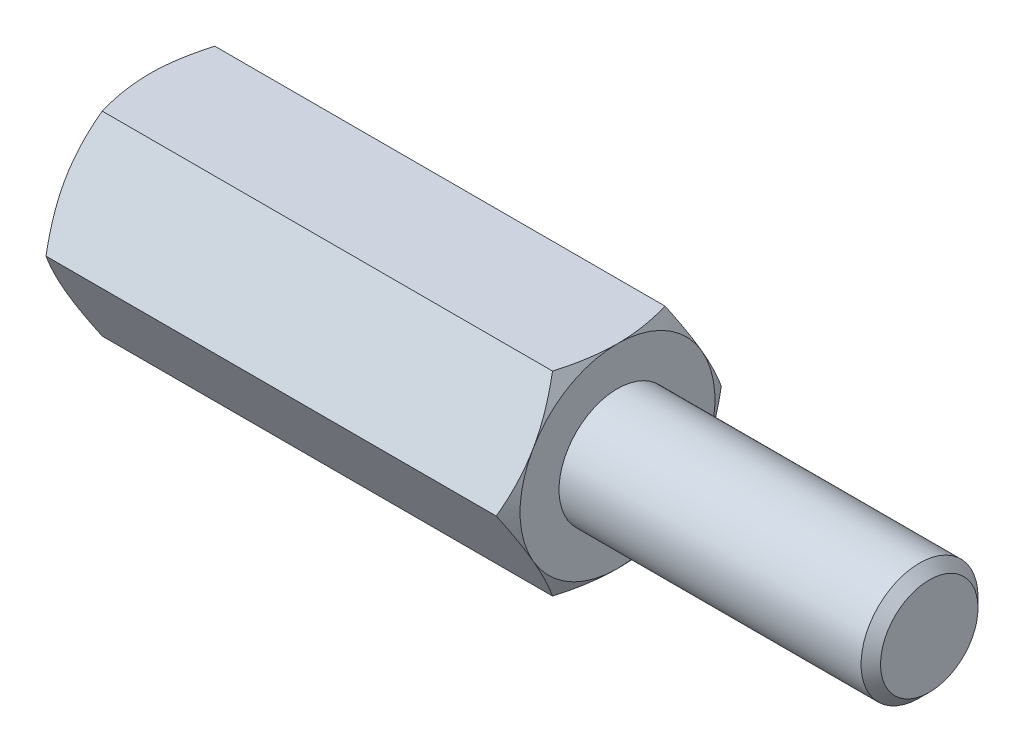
SolidWorks part; units mm, degrees
ref_plane "Front Plane" through (0, 0, 0) normal (0, 0, 1) x (1, 0, 0)
ref_plane "Top Plane" through (0, 0, 0) normal (0, 1, 0) x (1, 0, 0)
ref_plane "Right Plane" through (0, 0, 0) normal (1, 0, 0) x (0, 0, -1)
sketch "Sketch1" plane through (0, 0, 0) normal (1, 0, 0) x (0, 0, -1)
  line L1 (1.4434, 2.5) -> (-1.4434, 2.5)
  line L2 (-1.4434, 2.5) -> (-2.8868, 0)
  line L3 (-2.8868, 0) -> (-1.4434, -2.5)
  line L4 (-1.4434, -2.5) -> (1.4434, -2.5)
  line L5 (1.4434, -2.5) -> (2.8868, 0)
  line L6 (2.8868, 0) -> (1.4434, 2.5)
  circle A0 centre (0, 0) radius 2.5 construction
  dimension "D1" = 5
extrude "Extrude2" add sketch "Sketch1" along normal mid plane 12
sketch "Sketch2" plane through (0, 0, 0) normal (0, 0, 1) x (1, 0, 0)
  line L0 (-6, 2.5) -> (-4.5, 5.0981)
  line L1 (-6, 5.5) -> (-6, 2.5)
  line L3 (0, 0) -> (50000, 0) construction
  arc A0 (-4.5, 5.0981) -> (-6, 5.5) centre (-5.1962, 5.5) ccw
  dimension "D1" = 30
  dimension "D2" = 3
revolve "Cut-Revolve1" cut sketch "Sketch2" angle 360 about L3
mirror "Mirror1" about plane through (0, 0, 0) normal (1, 0, 0) of "Cut-Revolve1"
sketch "Sketch3" plane through (-6, 0, 0) normal (-1, 0, 0) x (0, 0, 1)
  circle A0 centre (0, 0) radius 1.25
  dimension "D1" = 2.5
extrude "Extrude3" cut sketch "Sketch3" against normal blind 8
sketch "Sketch4" plane through (0, 0, 0) normal (0, 0, 1) x (1, 0, 0)
  line L0 (2, 0) -> (2, 1.25)
  line L1 (5.7767, 0) -> (-5.7767, 0) construction
  line L2 (2, 1.25) -> (2.7217, 0)
  line L3 (2.7217, 0) -> (2, 0)
  line L4 (-6, 1.25) -> (-6, -1.25) construction
  point P4 (-6, 0)
  dimension "D1" = 30
  dimension "D2" = 1.25
  dimension "D3" = 8
revolve "Cut-Revolve2" cut sketch "Sketch4" angle 360 about L3
sketch "Sketch5" plane through (6, 0, 0) normal (1, 0, 0) x (0, 0, -1)
  circle A0 centre (0, 0) radius 1.5
  dimension "D1" = 3
extrude "Extrude4" add sketch "Sketch5" along normal blind 8
chamfer "Chamfer1" distance 0.25 angle 45 1 edges at (14, 0, -1.5)
equation "\"D2@Sketch4\" = \"D1@Sketch3\"/2"
